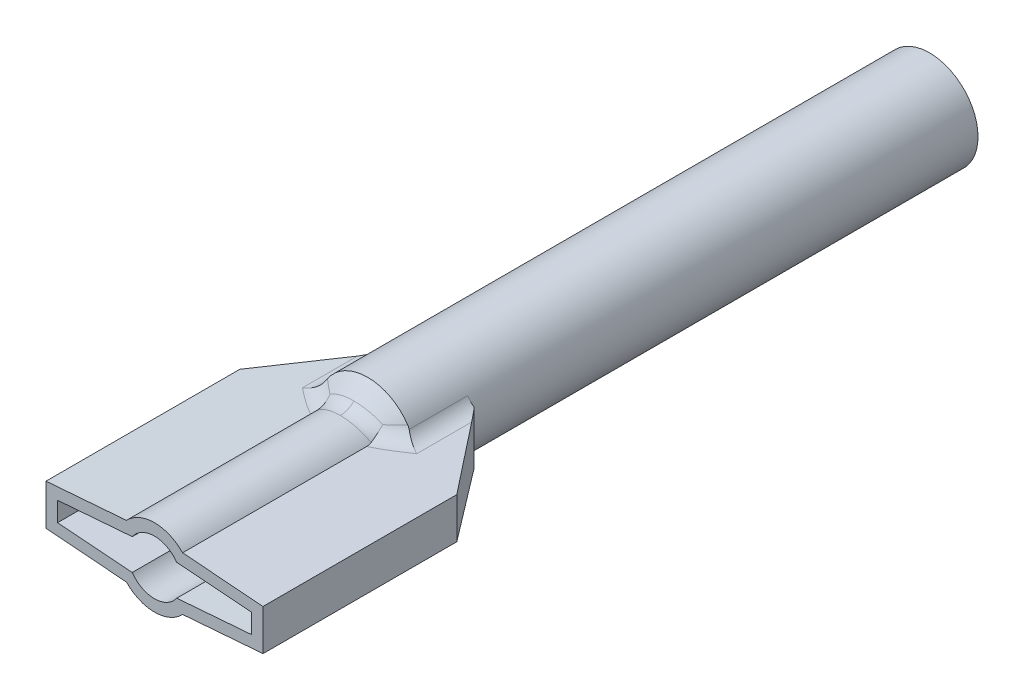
SolidWorks part; units mm, degrees
ref_plane "Vorne" through (0, 0, 0) normal (0, 0, 1) x (1, 0, 0)
ref_plane "Oben" through (0, 0, 0) normal (0, 1, 0) x (1, 0, 0)
ref_plane "Rechts" through (0, 0, 0) normal (1, 0, 0) x (0, 0, -1)
sketch "Skizze1" plane through (0, 0, 0) normal (0, 0, 1) x (1, 0, 0)
  line L0 (-0.5745, -0.4) -> (-2.5, -0.25)
  line L1 (-2.5, 0.25) -> (-0.5745, 0.4)
  line L2 (2.5, 0) -> (-2.5, 0) construction
  line L3 (0, -0.7) -> (0, 0.7) construction
  line L4 (-2.5, -0.25) -> (-2.5, 0.25)
  line L5 (2.5, -0.25) -> (2.5, 0.25)
  line L6 (2.5, 0.25) -> (0.5745, 0.4)
  line L7 (0.5745, -0.4) -> (2.5, -0.25)
  line L8 (-0.7246, -0.6892) -> (-2.8, -0.5275)
  line L9 (-2.8, -0.5275) -> (-2.8, 0.5275)
  line L10 (-2.8, 0.5275) -> (-0.7246, 0.6892)
  line L11 (2.8, 0.5275) -> (0.7246, 0.6892)
  line L12 (2.8, -0.5275) -> (2.8, 0.5275)
  line L13 (0.7246, -0.6892) -> (2.8, -0.5275)
  arc A0 (-0.5745, -0.4) -> (0.5745, -0.4) centre (0, 0) ccw
  arc A1 (0.5745, 0.4) -> (-0.5745, 0.4) centre (0, 0) ccw
  arc A2 (0.7246, 0.6892) -> (-0.7246, 0.6892) centre (0, 0) ccw
  arc A3 (-0.7246, -0.6892) -> (0.7246, -0.6892) centre (0, 0) ccw
  dimension "D1" = 5
  dimension "D2" = 0.7
  dimension "D3" = 0.5
  dimension "D4" = 0.8
  dimension "D5" = 0.3
extrude "Linear austragen1" add sketch "Skizze1" against normal blind 5
sketch "Skizze2" plane through (0, 0, 0) normal (1, 0, 0) x (0, 0, -1)
  line L0 (5, 0.25) -> (21.6248, 0.25) construction
  line L1 (0, -1) -> (5, -1) construction
  line L2 (5, 0.25) -> (20, 0.25)
  line L3 (5, 0.25) -> (5, -1)
  line L4 (5, -1) -> (20, -1)
  line L5 (20, 0.25) -> (20, -1)
  line L6 (0, -0.5275) -> (0, 0.5275) construction
  dimension "D1" = 5
  dimension "D2" = 1.25
  dimension "D3" = 20
revolve "Rotation1" add sketch "Skizze2" angle 360 about L0
sketch "Skizze4" plane through (0, 0, 0) normal (0, 1, 0) x (1, 0, 0)
  line L0 (-2.8, 5) -> (2.8, 5)
  line L1 (2.8, 5) -> (1.25, 7)
  line L2 (1.25, 5) -> (1.25, 20) construction
  line L3 (1.25, 7) -> (-1.25, 7)
  line L4 (-1.25, 20) -> (-1.25, 5) construction
  line L5 (-1.25, 7) -> (-2.8, 5)
  dimension "D1" = 2
extrude "Linear austragen3" add sketch "Skizze4" along normal through all and the other way through all
sketch "Skizze5" plane through (0, 0, -5) normal (0, 0, 1) x (1, 0, 0)
  line L0 (-0.7246, 0.6892) -> (-2.8, 0.5275) construction
  line L1 (-2.8, 1.5) -> (2.8, 1.5) construction
  line L2 (-2.8, 1.5) -> (-2.8, 0.5275) construction
  line L3 (-1.1831, 0.6535) -> (-2.8, 0.5275)
  line L4 (-2.8, 1.5) -> (0, 1.5)
  line L5 (-2.8, 1.5) -> (-2.8, 0.5275)
  line L6 (-2.8, -0.5275) -> (-0.7246, -0.6892) construction
  line L7 (-2.8, -1) -> (0, -1) construction
  line L8 (-2.8, -0.5275) -> (-2.8, -1) construction
  line L9 (-2.8, -0.5275) -> (-0.8345, -0.6807)
  line L10 (-2.8, -1) -> (0, -1)
  line L11 (-2.8, -0.5275) -> (-2.8, -1)
  arc A2 (-0.8345, -0.6807) -> (0, -1) centre (0, 0.25) ccw construction
  arc A3 (-0.8345, -0.6807) -> (0, -1) centre (0, 0.25) ccw
  arc A4 (0, 1.5) -> (-1.25, 0.25) centre (0, 0.25) ccw construction
  arc A5 (0, 1.5) -> (-1.1831, 0.6535) centre (0, 0.25) ccw
extrude "Schnitt-Linear austragen1" cut sketch "Skizze5" against normal up to surface
mirror "Spiegeln1" about plane through (0, 0, 0) normal (1, 0, 0) of "Schnitt-Linear austragen1"
chamfer "Fase2" distance 0.5 angle 45 4 edges at (0, 1.5, -5) (0.9538, 0.6714, -5) (0, 1, -5) (-0.9538, 0.6714, -5)
fillet "Verrundung1" radius 0.5 8 edges at (-1.1831, 0.6535, -6.25) (-1.2165, 0.6509, -7) (1.2165, 0.6509, -7) (1.1831, 0.6535, -6.25) (0.4548, 0.8906, -5.0356) (-0.3152, 0.949, -5.0168)
